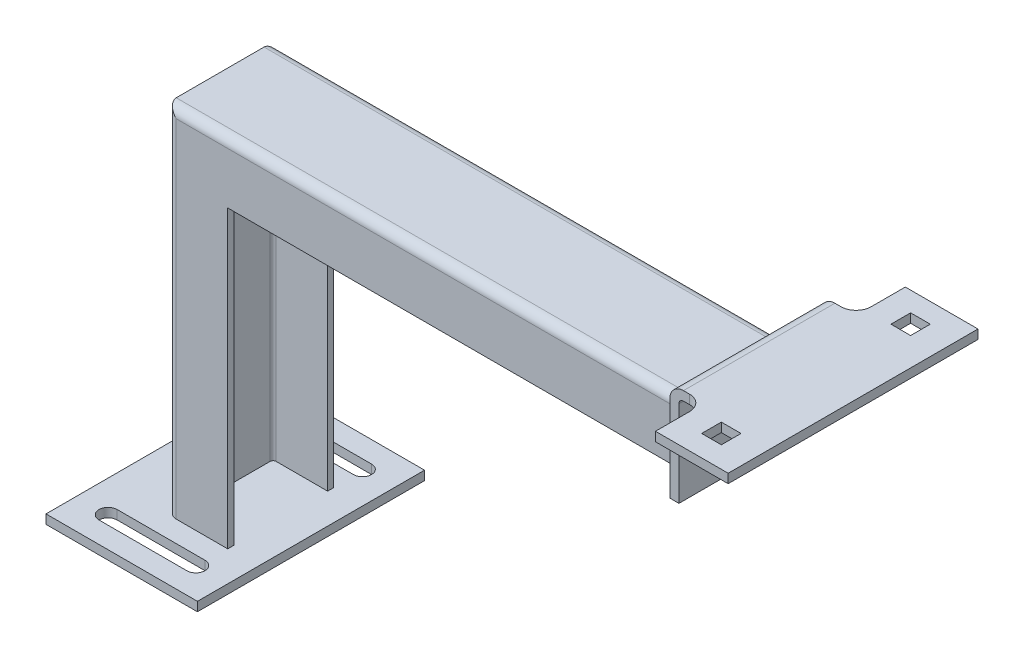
SolidWorks part; units mm, degrees
ref_plane "Face" through (0, 0, 0) normal (0, 0, 1) x (1, 0, 0)
ref_plane "Dessus" through (0, 0, 0) normal (0, 1, 0) x (1, 0, 0)
ref_plane "Droite" through (0, 0, 0) normal (1, 0, 0) x (0, 0, -1)
sketch "Esquisse1" plane through (0, 0, 0) normal (0, 0, 1) x (1, 0, 0)
  line L1 (-225, 105) -> (225, 105)
  line L2 (-225, 105) -> (-225, -130)
  line L3 (-225, -130) -> (225, -130)
  line L4 (225, 105) -> (225, -130)
  dimension "D1" = 450
  dimension "D2" = 235
  dimension "D3" = 105
  dimension "D4" = 225
extrude "Base-Extrusion" add sketch "Esquisse1" along normal blind 70
sketch "Esquisse6" plane through (0, 0, 70) normal (0, 0, 1) x (1, 0, 0)
  line L0 (-122.001, -130) -> (-122.001, 105)
  line L1 (-122.001, 105) -> (224.999, 105)
  line L3 (-82.001, 65) -> (224.999, 65)
  line L4 (224.999, 105) -> (224.999, 65)
  line L5 (-82.001, 65) -> (-82.001, -130)
  line L6 (-82.001, -130) -> (-122.001, -130)
  line L7 (-225, -130) -> (225, -130) construction
  line L8 (225, -130) -> (225, 105) construction
  dimension "D1" = 45
  dimension "D2" = 45
  dimension "D3" = 235
  dimension "D4" = 0.001
  dimension "D5" = 40
  dimension "D6" = 40
  dimension "D7" = 235
  dimension "D8" = 347
extrude "Enlèv. mat.-Extru.2" cut sketch "Esquisse6" against normal through all flip side to cut
ref_plane "Plan1" through (0, 0, 4) normal (0, 0, 1) x (1, 0, 0)
sketch "Esquisse8" plane through (0, 0, 4) normal (0, 0, 1) x (1, 0, 0)
  line L0 (-118.001, 101) -> (-118.001, -149.1487)
  line L1 (-118.001, 101) -> (224.999, 101)
  line L3 (-82.001, 65) -> (224.999, 65)
  line L4 (224.999, 101) -> (224.999, 65)
  line L5 (-118.001, -149.1487) -> (-82.001, -149.1487)
  line L6 (-82.001, -149.1487) -> (-82.001, 65)
  line L12 (-82.001, -130) -> (-82.001, 65) construction
  line L14 (224.999, 65) -> (224.999, 105) construction
  line L15 (-82.001, 65) -> (224.999, 65) construction
  dimension "D1" = 36
  dimension "D2" = 36
extrude "Enlèv. mat.-Extru.3" cut sketch "Esquisse8" along normal blind 62
sketch "Esquisse9" plane through (0, -130, 0) normal (0, -1, 0) x (1, 0, 0)
  line L1 (-162.001, 110) -> (-62.001, 110)
  line L2 (-162.001, 110) -> (-162.001, -40)
  line L3 (-162.001, -40) -> (-62.001, -40)
  line L4 (-62.001, 110) -> (-62.001, -40)
  line L7 (-82.001, 70) -> (224.999, 70) construction
  line L8 (-122.001, 0) -> (-122.001, 70) construction
  line L10 (-141.001, 84) -> (-83.001, 84)
  line L11 (-141.001, 96) -> (-83.001, 96)
  line L12 (-141.001, -14) -> (-83.001, -14)
  line L13 (-141.001, -26) -> (-83.001, -26)
  arc A0 (-141.001, 96) -> (-141.001, 84) centre (-141.001, 90) ccw
  arc A1 (-83.001, 84) -> (-83.001, 96) centre (-83.001, 90) ccw
  arc A2 (-83.001, -26) -> (-83.001, -14) centre (-83.001, -20) ccw
  arc A3 (-141.001, -14) -> (-141.001, -26) centre (-141.001, -20) ccw
  dimension "D5" = 12
  dimension "D6" = 12
  dimension "D7" = 12
  dimension "D8" = 12
  dimension "D1" = 100
  dimension "D2" = 150
  dimension "D3" = 40
  dimension "D4" = 40
  dimension "D9" = 58
  dimension "D10" = 21
  dimension "D11" = 58
  dimension "D12" = 21
  dimension "D13" = 110
  dimension "D14" = 110
  dimension "D15" = 20
  dimension "D16" = 20
extrude "Boss.-Extru.4" add sketch "Esquisse9" along normal blind 6
sketch "Esquisse11" plane through (224.999, 0, 0) normal (1, 0, 0) x (0, 0, -1)
  line L0 (0, 65) -> (-4, 65) construction
  line L1 (-85, 126) -> (15, 126)
  line L2 (-85, 126) -> (-85, 60)
  line L3 (-85, 60) -> (15, 60)
  line L4 (15, 126) -> (15, 60)
  line L5 (0, 65) -> (0, 105) construction
  line L7 (-42, 92) -> (-29, 92)
  line L8 (-42, 92) -> (-42, 79)
  line L9 (-42, 79) -> (-29, 79)
  line L10 (-29, 92) -> (-29, 79)
  dimension "D1" = 100
  dimension "D2" = 66
  dimension "D3" = 5
  dimension "D4" = 15
  dimension "D5" = 13
  dimension "D6" = 13
  dimension "D7" = 19
  dimension "D8" = 44
extrude "Boss.-Extru.5" add sketch "Esquisse11" along normal blind 6
sketch "Esquisse12" plane through (230.999, 0, 0) normal (1, 0, 0) x (0, 0, -1)
  line L0 (15, 126) -> (-85, 126) construction
  line L1 (-117.5, 126) -> (47.5, 126)
  line L2 (-117.5, 126) -> (-117.5, 120)
  line L3 (-117.5, 120) -> (47.5, 120)
  line L4 (47.5, 126) -> (47.5, 120)
  line L6 (15, 60) -> (15, 126) construction
  dimension "D1" = 6
  dimension "D2" = 165
  dimension "D3" = 32.5
  dimension "D4" = 6
extrude "Boss.-Extru.6" add sketch "Esquisse12" along normal blind 65
sketch "Esquisse13" plane through (0, 126, 0) normal (0, 1, 0) x (-1, 0, 0)
  line L0 (-247.999, -47.5) -> (-247.999, -25)
  line L1 (-295.999, -47.5) -> (-295.999, 117.5) construction
  line L2 (-224.999, 85) -> (-237.999, 85)
  line L3 (-224.999, -15) -> (-237.999, -15)
  line L4 (-295.999, -47.5) -> (-230.999, -47.5) construction
  line L5 (-277.499, 90.5) -> (-264.499, 90.5)
  line L6 (-277.499, 90.5) -> (-277.499, 103.5)
  line L7 (-277.499, 103.5) -> (-264.499, 103.5)
  line L8 (-264.499, 90.5) -> (-264.499, 103.5)
  line L9 (-277.499, -34.5) -> (-264.499, -34.5)
  line L10 (-277.499, -34.5) -> (-277.499, -21.5)
  line L11 (-277.499, -21.5) -> (-264.499, -21.5)
  line L12 (-264.499, -34.5) -> (-264.499, -21.5)
  line L13 (-224.999, -47.5) -> (-247.999, -47.5)
  line L14 (-224.999, 117.5) -> (-247.999, 117.5)
  line L15 (-224.999, -47.5) -> (-224.999, -15)
  line L16 (-224.999, -15) -> (-224.999, 85) construction
  line L17 (-247.999, 95) -> (-247.999, 117.5)
  line L18 (-224.999, 85) -> (-224.999, 117.5)
  arc A0 (-247.999, 95) -> (-237.999, 85) centre (-237.999, 95) ccw
  arc A1 (-237.999, -15) -> (-247.999, -25) centre (-237.999, -25) ccw
  dimension "D9" = 20
  dimension "D10" = 20
  dimension "D1" = 48
  dimension "D2" = 13
  dimension "D3" = 13
  dimension "D4" = 13
  dimension "D5" = 13
  dimension "D6" = 112
  dimension "D7" = 13
  dimension "D8" = 18.5
extrude "Enlèv. mat.-Extru.5" cut sketch "Esquisse13" against normal blind 6
fillet "Congé1" radius 6 4 edges at (51.499, 105, 0) (51.499, 105, 70) (-122.001, -12.5, 0) (-122.001, -12.5, 70)
fillet "Congé2" radius 2 4 edges at (-118.001, -14.5, 4) (53.499, 101, 66) (-118.001, -14.5, 66) (53.499, 101, 4)
fillet "Congé3" radius 3 1 edges at (230.999, 120, 35)
fillet "Congé4" radius 9 1 edges at (224.999, 126, 35)
